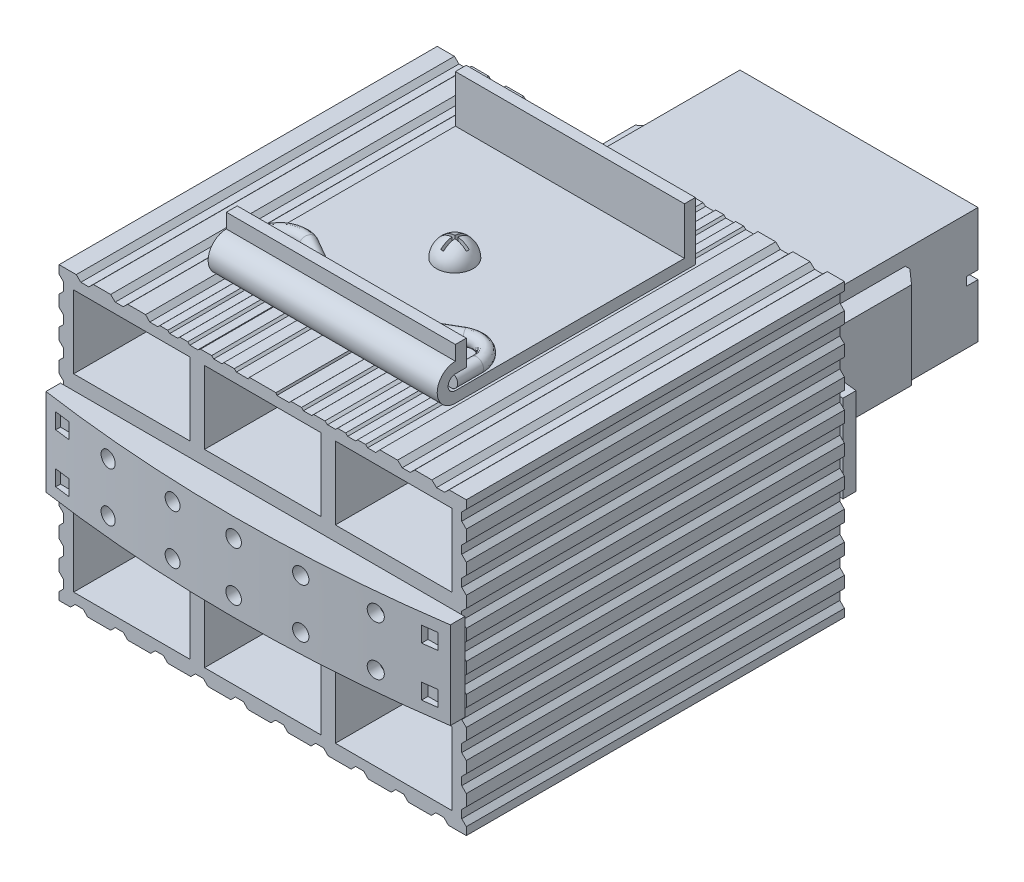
SolidWorks part; units mm, degrees
other "LUMP1"
ref_plane "Спереди" through (0, 0, 0) normal (0, 0, 1) x (1, 0, 0)
ref_plane "Сверху" through (0, 0, 0) normal (0, 1, 0) x (1, 0, 0)
ref_plane "Справа" through (0, 0, 0) normal (1, 0, 0) x (0, 0, -1)
imported_body "Импортированный1"
sketch "Эскиз1" plane through (0, 0, 66.04) normal (0, 0, 1) x (1, 0, 0)
  line L0 (-35.56, 23.9572) -> (-34.76, 23.1572)
  line L1 (-35.56, 25.4) -> (-35.56, -25.4) construction
  line L2 (-34.76, 23.1572) -> (-34.76, 21.7572)
  line L3 (-34.76, 21.7572) -> (-35.56, 20.9572)
  line L4 (-35.56, 20.9572) -> (-36.4722, 20.9572)
  line L5 (-36.4722, 20.9572) -> (-36.4722, 23.9572)
  line L6 (-36.4722, 23.9572) -> (-35.56, 23.9572)
  line L7 (-35.56, 18.9572) -> (-34.76, 18.1572)
  line L8 (-34.76, 18.1572) -> (-34.76, 16.7572)
  line L9 (-34.76, 16.7572) -> (-35.56, 15.9572)
  line L10 (-35.56, 15.9572) -> (-36.4722, 15.9572)
  line L11 (-36.4722, 15.9572) -> (-36.4722, 18.9572)
  line L12 (-36.4722, 18.9572) -> (-35.56, 18.9572)
  line L13 (-35.56, 13.9572) -> (-34.76, 13.1572)
  line L14 (-34.76, 13.1572) -> (-34.76, 11.7572)
  line L15 (-34.76, 11.7572) -> (-35.56, 10.9572)
  line L16 (-35.56, 10.9572) -> (-36.4722, 10.9572)
  line L17 (-36.4722, 10.9572) -> (-36.4722, 13.9572)
  line L18 (-36.4722, 13.9572) -> (-35.56, 13.9572)
  line L19 (-35.56, 8.9572) -> (-34.76, 8.1572)
  line L20 (-34.76, 8.1572) -> (-34.76, 6.7572)
  line L21 (-34.76, 6.7572) -> (-35.56, 5.9572)
  line L22 (-35.56, 5.9572) -> (-36.4722, 5.9572)
  line L23 (-36.4722, 5.9572) -> (-36.4722, 8.9572)
  line L24 (-36.4722, 8.9572) -> (-35.56, 8.9572)
  line L25 (-35.56, 3.9572) -> (-34.76, 3.1572)
  line L26 (-34.76, 3.1572) -> (-34.76, 1.7572)
  line L27 (-34.76, 1.7572) -> (-35.56, 0.9572)
  line L28 (-35.56, 0.9572) -> (-36.4722, 0.9572)
  line L29 (-36.4722, 0.9572) -> (-36.4722, 3.9572)
  line L30 (-36.4722, 3.9572) -> (-35.56, 3.9572)
  line L31 (-35.56, -1.0428) -> (-34.76, -1.8428)
  line L32 (-34.76, -1.8428) -> (-34.76, -3.2428)
  line L33 (-34.76, -3.2428) -> (-35.56, -4.0428)
  line L34 (-35.56, -4.0428) -> (-36.4722, -4.0428)
  line L35 (-36.4722, -4.0428) -> (-36.4722, -1.0428)
  line L36 (-36.4722, -1.0428) -> (-35.56, -1.0428)
  line L37 (-35.56, -6.0428) -> (-34.76, -6.8428)
  line L38 (-34.76, -6.8428) -> (-34.76, -8.2428)
  line L39 (-34.76, -8.2428) -> (-35.56, -9.0428)
  line L40 (-35.56, -9.0428) -> (-36.4722, -9.0428)
  line L41 (-36.4722, -9.0428) -> (-36.4722, -6.0428)
  line L42 (-36.4722, -6.0428) -> (-35.56, -6.0428)
  line L43 (-35.56, -11.0428) -> (-34.76, -11.8428)
  line L44 (-34.76, -11.8428) -> (-34.76, -13.2428)
  line L45 (-34.76, -13.2428) -> (-35.56, -14.0428)
  line L46 (-35.56, -14.0428) -> (-36.4722, -14.0428)
  line L47 (-36.4722, -14.0428) -> (-36.4722, -11.0428)
  line L48 (-36.4722, -11.0428) -> (-35.56, -11.0428)
  line L49 (-35.56, -16.0428) -> (-34.76, -16.8428)
  line L50 (-34.76, -16.8428) -> (-34.76, -18.2428)
  line L51 (-34.76, -18.2428) -> (-35.56, -19.0428)
  line L52 (-35.56, -19.0428) -> (-36.4722, -19.0428)
  line L53 (-36.4722, -19.0428) -> (-36.4722, -16.0428)
  line L54 (-36.4722, -16.0428) -> (-35.56, -16.0428)
  line L55 (-35.56, -21.0428) -> (-34.76, -21.8428)
  line L56 (-34.76, -21.8428) -> (-34.76, -23.2428)
  line L57 (-34.76, -23.2428) -> (-35.56, -24.0428)
  line L58 (-35.56, -24.0428) -> (-36.4722, -24.0428)
  line L59 (-36.4722, -24.0428) -> (-36.4722, -21.0428)
  line L60 (-36.4722, -21.0428) -> (-35.56, -21.0428)
  line L61 (0, 0) -> (0, -10.16) construction
  line L62 (-10.16, -10.16) -> (10.16, -10.16) construction
  line L63 (36.4722, -21.0428) -> (35.56, -21.0428)
  line L64 (36.4722, -24.0428) -> (36.4722, -21.0428)
  line L65 (35.56, -24.0428) -> (36.4722, -24.0428)
  line L66 (34.76, -23.2428) -> (35.56, -24.0428)
  line L67 (34.76, -21.8428) -> (34.76, -23.2428)
  line L68 (35.56, -21.0428) -> (34.76, -21.8428)
  line L69 (36.4722, -16.0428) -> (35.56, -16.0428)
  line L70 (36.4722, -19.0428) -> (36.4722, -16.0428)
  line L71 (35.56, -19.0428) -> (36.4722, -19.0428)
  line L72 (34.76, -18.2428) -> (35.56, -19.0428)
  line L73 (34.76, -16.8428) -> (34.76, -18.2428)
  line L74 (35.56, -16.0428) -> (34.76, -16.8428)
  line L75 (36.4722, -11.0428) -> (35.56, -11.0428)
  line L76 (36.4722, -14.0428) -> (36.4722, -11.0428)
  line L77 (35.56, -14.0428) -> (36.4722, -14.0428)
  line L78 (34.76, -13.2428) -> (35.56, -14.0428)
  line L79 (34.76, -11.8428) -> (34.76, -13.2428)
  line L80 (35.56, -11.0428) -> (34.76, -11.8428)
  line L81 (36.4722, -6.0428) -> (35.56, -6.0428)
  line L82 (36.4722, -9.0428) -> (36.4722, -6.0428)
  line L83 (35.56, -9.0428) -> (36.4722, -9.0428)
  line L84 (34.76, -8.2428) -> (35.56, -9.0428)
  line L85 (34.76, -6.8428) -> (34.76, -8.2428)
  line L86 (35.56, -6.0428) -> (34.76, -6.8428)
  line L87 (36.4722, -1.0428) -> (35.56, -1.0428)
  line L88 (36.4722, -4.0428) -> (36.4722, -1.0428)
  line L89 (35.56, -4.0428) -> (36.4722, -4.0428)
  line L90 (34.76, -3.2428) -> (35.56, -4.0428)
  line L91 (34.76, -1.8428) -> (34.76, -3.2428)
  line L92 (35.56, -1.0428) -> (34.76, -1.8428)
  line L93 (36.4722, 3.9572) -> (35.56, 3.9572)
  line L94 (36.4722, 0.9572) -> (36.4722, 3.9572)
  line L95 (35.56, 0.9572) -> (36.4722, 0.9572)
  line L96 (34.76, 1.7572) -> (35.56, 0.9572)
  line L97 (34.76, 3.1572) -> (34.76, 1.7572)
  line L98 (35.56, 3.9572) -> (34.76, 3.1572)
  line L99 (36.4722, 8.9572) -> (35.56, 8.9572)
  line L100 (36.4722, 5.9572) -> (36.4722, 8.9572)
  line L101 (35.56, 5.9572) -> (36.4722, 5.9572)
  line L102 (34.76, 6.7572) -> (35.56, 5.9572)
  line L103 (34.76, 8.1572) -> (34.76, 6.7572)
  line L104 (35.56, 8.9572) -> (34.76, 8.1572)
  line L105 (36.4722, 13.9572) -> (35.56, 13.9572)
  line L106 (36.4722, 10.9572) -> (36.4722, 13.9572)
  line L107 (35.56, 10.9572) -> (36.4722, 10.9572)
  line L108 (34.76, 11.7572) -> (35.56, 10.9572)
  line L109 (34.76, 13.1572) -> (34.76, 11.7572)
  line L110 (35.56, 13.9572) -> (34.76, 13.1572)
  line L111 (36.4722, 18.9572) -> (35.56, 18.9572)
  line L112 (36.4722, 15.9572) -> (36.4722, 18.9572)
  line L113 (35.56, 15.9572) -> (36.4722, 15.9572)
  line L114 (34.76, 16.7572) -> (35.56, 15.9572)
  line L115 (34.76, 18.1572) -> (34.76, 16.7572)
  line L116 (35.56, 18.9572) -> (34.76, 18.1572)
  line L117 (36.4722, 23.9572) -> (35.56, 23.9572)
  line L118 (36.4722, 20.9572) -> (36.4722, 23.9572)
  line L119 (35.56, 20.9572) -> (36.4722, 20.9572)
  line L120 (34.76, 21.7572) -> (35.56, 20.9572)
  line L121 (34.76, 23.1572) -> (34.76, 21.7572)
  line L122 (35.56, 23.9572) -> (34.76, 23.1572)
  dimension "D2" = 0.8
  dimension "D3" = 1.4
  dimension "D4" = 3
  dimension "D1" = 10
extrude "Вырез-Вытянуть1" cut sketch "Эскиз1" against normal up to surface (66.04 mm away)
sketch "Эскиз2" plane through (0, 0, 66.04) normal (0, 0, 1) x (1, 0, 0)
  line L0 (-33.56, -25.4) -> (-32.76, -24.6)
  line L1 (-35.56, -25.4) -> (35.56, -25.4) construction
  line L2 (-32.76, -24.6) -> (-31.36, -24.6)
  line L3 (-31.36, -24.6) -> (-30.56, -25.4)
  line L4 (-30.56, -25.4) -> (-30.56, -26.3489)
  line L5 (-30.56, -26.3489) -> (-33.56, -26.3489)
  line L6 (-33.56, -26.3489) -> (-33.56, -25.4)
  line L7 (-26.56, -25.4) -> (-25.76, -24.6)
  line L8 (-25.76, -24.6) -> (-24.36, -24.6)
  line L9 (-24.36, -24.6) -> (-23.56, -25.4)
  line L10 (-23.56, -25.4) -> (-23.56, -26.3489)
  line L11 (-23.56, -26.3489) -> (-26.56, -26.3489)
  line L12 (-26.56, -26.3489) -> (-26.56, -25.4)
  line L13 (-19.56, -25.4) -> (-18.76, -24.6)
  line L14 (-18.76, -24.6) -> (-17.36, -24.6)
  line L15 (-17.36, -24.6) -> (-16.56, -25.4)
  line L16 (-16.56, -25.4) -> (-16.56, -26.3489)
  line L17 (-16.56, -26.3489) -> (-19.56, -26.3489)
  line L18 (-19.56, -26.3489) -> (-19.56, -25.4)
  line L19 (-12.56, -25.4) -> (-11.76, -24.6)
  line L20 (-11.76, -24.6) -> (-10.36, -24.6)
  line L21 (-10.36, -24.6) -> (-9.56, -25.4)
  line L22 (-9.56, -25.4) -> (-9.56, -26.3489)
  line L23 (-9.56, -26.3489) -> (-12.56, -26.3489)
  line L24 (-12.56, -26.3489) -> (-12.56, -25.4)
  line L25 (-5.56, -25.4) -> (-4.76, -24.6)
  line L26 (-4.76, -24.6) -> (-3.36, -24.6)
  line L27 (-3.36, -24.6) -> (-2.56, -25.4)
  line L28 (-2.56, -25.4) -> (-2.56, -26.3489)
  line L29 (-2.56, -26.3489) -> (-5.56, -26.3489)
  line L30 (-5.56, -26.3489) -> (-5.56, -25.4)
  line L31 (1.44, -25.4) -> (2.24, -24.6)
  line L32 (2.24, -24.6) -> (3.64, -24.6)
  line L33 (3.64, -24.6) -> (4.44, -25.4)
  line L34 (4.44, -25.4) -> (4.44, -26.3489)
  line L35 (4.44, -26.3489) -> (1.44, -26.3489)
  line L36 (1.44, -26.3489) -> (1.44, -25.4)
  line L37 (8.44, -25.4) -> (9.24, -24.6)
  line L38 (9.24, -24.6) -> (10.64, -24.6)
  line L39 (10.64, -24.6) -> (11.44, -25.4)
  line L40 (11.44, -25.4) -> (11.44, -26.3489)
  line L41 (11.44, -26.3489) -> (8.44, -26.3489)
  line L42 (8.44, -26.3489) -> (8.44, -25.4)
  line L43 (15.44, -25.4) -> (16.24, -24.6)
  line L44 (16.24, -24.6) -> (17.64, -24.6)
  line L45 (17.64, -24.6) -> (18.44, -25.4)
  line L46 (18.44, -25.4) -> (18.44, -26.3489)
  line L47 (18.44, -26.3489) -> (15.44, -26.3489)
  line L48 (15.44, -26.3489) -> (15.44, -25.4)
  line L49 (22.44, -25.4) -> (23.24, -24.6)
  line L50 (23.24, -24.6) -> (24.64, -24.6)
  line L51 (24.64, -24.6) -> (25.44, -25.4)
  line L52 (25.44, -25.4) -> (25.44, -26.3489)
  line L53 (25.44, -26.3489) -> (22.44, -26.3489)
  line L54 (22.44, -26.3489) -> (22.44, -25.4)
  line L55 (29.44, -25.4) -> (30.24, -24.6)
  line L56 (30.24, -24.6) -> (31.64, -24.6)
  line L57 (31.64, -24.6) -> (32.44, -25.4)
  line L58 (32.44, -25.4) -> (32.44, -26.3489)
  line L59 (32.44, -26.3489) -> (29.44, -26.3489)
  line L60 (29.44, -26.3489) -> (29.44, -25.4)
  dimension "D1" = 0.8
  dimension "D2" = 1.4
  dimension "D3" = 3
  dimension "D4" = 2
  dimension "D5" = 10
extrude "Вырез-Вытянуть2" cut sketch "Эскиз2" against normal up to surface (66.04 mm away)
sketch "Эскиз3" plane through (0, 0, 66.04) normal (0, 0, 1) x (1, 0, 0)
  line L0 (-32.56, 25.4) -> (-31.76, 24.637)
  line L1 (35.56, 25.4) -> (-35.56, 25.4) construction
  line L2 (-31.76, 24.637) -> (-30.36, 24.637)
  line L3 (-30.36, 24.637) -> (-29.56, 25.4)
  line L4 (-29.56, 25.4) -> (-29.56, 26.4354)
  line L5 (-29.56, 26.4354) -> (-32.56, 26.4354)
  line L6 (-32.56, 26.4354) -> (-32.56, 25.4)
  line L7 (-26.56, 25.4) -> (-25.76, 24.637)
  line L8 (-25.76, 24.637) -> (-24.36, 24.637)
  line L9 (-24.36, 24.637) -> (-23.56, 25.4)
  line L10 (-23.56, 25.4) -> (-23.56, 26.4354)
  line L11 (-23.56, 26.4354) -> (-26.56, 26.4354)
  line L12 (-26.56, 26.4354) -> (-26.56, 25.4)
  line L13 (-20.4518, 25.4) -> (-19.7242, 24.637)
  line L14 (-19.7242, 24.637) -> (-18.3242, 24.637)
  line L15 (-18.3242, 24.637) -> (-17.9677, 24.977)
  line L16 (-17.9677, 24.977) -> (-16.5677, 24.977)
  line L17 (-16.5677, 24.977) -> (-16.2435, 24.637)
  line L18 (-16.2435, 24.637) -> (-14.8435, 24.637)
  line L19 (-14.8435, 24.637) -> (-14.487, 24.977)
  line L20 (-14.487, 24.977) -> (-13.087, 24.977)
  line L21 (-13.087, 24.977) -> (-12.7306, 24.637)
  line L22 (-12.7306, 24.637) -> (-11.3306, 24.637)
  line L23 (-11.3306, 24.637) -> (-10.8597, 24.977)
  line L24 (-10.8597, 24.977) -> (-8.9153, 24.977)
  line L25 (0, 25.4) -> (0, 18.4841) construction
  line L26 (-8.9153, 24.977) -> (-8.5589, 24.637)
  line L27 (-8.5589, 24.637) -> (-7.1071, 24.637)
  line L28 (-7.1071, 24.637) -> (-6.7829, 24.977)
  line L29 (-6.7829, 24.977) -> (-4.9544, 24.977)
  line L30 (-4.9544, 24.977) -> (-4.598, 24.637)
  line L31 (-4.598, 24.637) -> (-2.4717, 24.637)
  line L32 (-2.4717, 24.637) -> (-2.3139, 24.977)
  line L33 (-2.3139, 24.977) -> (2.3139, 24.977)
  line L34 (2.4717, 24.637) -> (2.3139, 24.977)
  line L35 (4.598, 24.637) -> (2.4717, 24.637)
  line L36 (4.9544, 24.977) -> (4.598, 24.637)
  line L37 (6.7829, 24.977) -> (4.9544, 24.977)
  line L38 (7.1071, 24.637) -> (6.7829, 24.977)
  line L39 (8.5589, 24.637) -> (7.1071, 24.637)
  line L40 (8.9153, 24.977) -> (8.5589, 24.637)
  line L41 (10.8597, 24.977) -> (8.9153, 24.977)
  line L42 (11.3306, 24.637) -> (10.8597, 24.977)
  line L43 (12.7306, 24.637) -> (11.3306, 24.637)
  line L44 (13.087, 24.977) -> (12.7306, 24.637)
  line L45 (14.487, 24.977) -> (13.087, 24.977)
  line L46 (14.8435, 24.637) -> (14.487, 24.977)
  line L47 (16.2435, 24.637) -> (14.8435, 24.637)
  line L48 (16.5677, 24.977) -> (16.2435, 24.637)
  line L49 (17.9677, 24.977) -> (16.5677, 24.977)
  line L50 (18.3242, 24.637) -> (17.9677, 24.977)
  line L51 (19.7242, 24.637) -> (18.3242, 24.637)
  line L52 (20.4518, 25.4) -> (19.7242, 24.637)
  line L53 (26.56, 26.4354) -> (26.56, 25.4)
  line L54 (23.56, 26.4354) -> (26.56, 26.4354)
  line L55 (23.56, 25.4) -> (23.56, 26.4354)
  line L56 (24.36, 24.637) -> (23.56, 25.4)
  line L57 (25.76, 24.637) -> (24.36, 24.637)
  line L58 (26.56, 25.4) -> (25.76, 24.637)
  line L59 (32.56, 26.4354) -> (32.56, 25.4)
  line L60 (29.56, 26.4354) -> (32.56, 26.4354)
  line L61 (29.56, 25.4) -> (29.56, 26.4354)
  line L62 (30.36, 24.637) -> (29.56, 25.4)
  line L63 (31.76, 24.637) -> (30.36, 24.637)
  line L64 (32.56, 25.4) -> (31.76, 24.637)
  line L65 (20.4518, 25.4) -> (20.4518, 25.6267)
  line L66 (20.4518, 25.6267) -> (20.0025, 25.6267)
  line L67 (20.0025, 25.4) -> (20.0025, 31.75) construction
  line L68 (20.0025, 25.6267) -> (20.0025, 25.4)
  line L69 (20.0025, 25.4) -> (-20.0025, 25.4)
  line L70 (-20.0025, 25.4) -> (-20.0025, 25.6089)
  line L71 (-20.0025, 31.75) -> (-20.0025, 25.4) construction
  line L72 (-20.0025, 25.6089) -> (-20.4518, 25.6089)
  line L73 (-20.4518, 25.6089) -> (-20.4518, 25.4)
  point P40 (0, 24.977)
  dimension "D1" = 3
  dimension "D2" = 0.8
  dimension "D3" = 1.4
  dimension "D5" = 1.4
  dimension "D6" = 1.4
  dimension "D7" = 1.4
  dimension "D8" = 1.4
  dimension "D9" = 1.4
  dimension "D10" = 3
  dimension "D4" = 2
extrude "Вырез-Вытянуть3" cut sketch "Эскиз3" against normal up to surface (66.04 mm away)
ref_plane "Плоскость1" through (0, 0, 72.04) normal (0, 0, 1) x (1, 0, 0)
sketch "Эскиз4" plane through (0, 0, 72.04) normal (0, 0, 1) x (1, 0, 0)
  line L0 (-35.306, 0) -> (-12.5766, 0) construction
  line L1 (-35.306, -7.62) -> (-35.306, 7.62) construction
  line L2 (33.398, -5.6739) -> (33.398, -2.949)
  line L3 (-33.3281, 5.6739) -> (-30.673, 5.6739)
  line L4 (-33.3281, 5.6739) -> (-33.3281, 2.949)
  line L5 (-33.3281, 2.949) -> (-30.673, 2.949)
  line L6 (-30.673, 5.6739) -> (-30.673, 2.949)
  line L7 (30.8826, 5.6739) -> (33.398, 5.6739)
  line L8 (30.8826, 5.6739) -> (30.8826, 2.949)
  line L9 (30.8826, 2.949) -> (33.398, 2.949)
  line L10 (33.398, 5.6739) -> (33.398, 2.949)
  line L11 (30.8826, -2.949) -> (33.398, -2.949)
  line L12 (30.8826, -5.6739) -> (30.8826, -2.949)
  line L13 (30.8826, -5.6739) -> (33.398, -5.6739)
  line L14 (-30.673, -5.6739) -> (-30.673, -2.949)
  line L15 (-33.3281, -2.949) -> (-30.673, -2.949)
  line L16 (-33.3281, -5.6739) -> (-33.3281, -2.949)
  line L17 (-33.3281, -5.6739) -> (-30.673, -5.6739)
  circle A0 centre (-22.9873, 4.3115) radius 1.3625
  circle A1 centre (-10.8998, 4.3115) radius 1.3625
  circle A2 centre (0, 4.3115) radius 1.3625
  circle A3 centre (11.4587, 4.3115) radius 1.3625
  circle A4 centre (23.686, 4.3115) radius 1.3625
  circle A5 centre (23.686, -4.3115) radius 1.3625
  circle A6 centre (11.4587, -4.3115) radius 1.3625
  circle A7 centre (0, -4.3115) radius 1.3625
  circle A8 centre (-10.8998, -4.3115) radius 1.3625
  circle A9 centre (-22.9873, -4.3115) radius 1.3625
extrude "Вырез-Вытянуть4" cut sketch "Эскиз4" against normal blind 4
sketch "Эскиз5" plane through (0, -10.16, 0) normal (0, -1, 0) x (1, 0, 0)
  line L0 (-18.2499, -35.56) -> (-18.2499, -30.48) construction
  line L1 (-6.6724, -7.3267) -> (-5.9724, -7.3267)
  line L2 (-6.6724, -7.3267) -> (-6.6724, -35.8124)
  line L3 (-19.4499, -36.1399) -> (19.3448, -36.1399)
  line L4 (-5.9724, -7.3267) -> (-5.9724, -35.8124)
  line L5 (6.5957, -7.3267) -> (5.8957, -7.3267)
  line L6 (6.5957, -7.3267) -> (6.5957, -35.8124)
  line L8 (5.8957, -7.3267) -> (5.8957, -35.8124)
  line L9 (18.6448, -7.3267) -> (19.3448, -7.3267)
  line L10 (18.6448, -7.3267) -> (18.6448, -35.8124)
  line L12 (19.3448, -7.3267) -> (19.3448, -36.1399)
  line L13 (-18.6499, -7.3267) -> (-19.4499, -7.3267)
  line L14 (-18.6499, -7.3267) -> (-18.6499, -35.8124)
  line L16 (-19.4499, -7.3267) -> (-19.4499, -36.1399)
  line L17 (18.2448, -35.56) -> (18.2448, -30.48) construction
  line L18 (-18.6499, -35.8124) -> (-6.6724, -35.8124)
  line L20 (-5.9724, -35.8124) -> (5.8957, -35.8124)
  line L22 (6.5957, -35.8124) -> (18.6448, -35.8124)
  dimension "D1" = 0.8
  dimension "D2" = 0.7
  dimension "D3" = 0.7
  dimension "D4" = 0.7
  dimension "D5" = 0.4
  dimension "D6" = 0.4
extrude "Вырез-Вытянуть5" cut sketch "Эскиз5" against normal blind 2
sketch "Эскиз6" plane through (0, -11.684, 0) normal (0, -1, 0) x (1, 0, 0)
  circle A0 centre (-12.5908, -33.02) radius 2.0037
extrude "Вырез-Вытянуть6" cut sketch "Эскиз6" against normal blind 0.5
sketch "Эскиз7" plane through (0, -11.184, 0) normal (0, -1, 0) x (1, 0, 0)
  line L0 (-12.5908, -31.0163) -> (-12.5908, -36.3312) construction
  line L2 (-13.5908, -34.1084) -> (-11.5908, -34.1084)
  line L3 (-13.5908, -34.1084) -> (-13.5908, -34.3484)
  line L4 (-13.5908, -34.3484) -> (-11.5908, -34.3484)
  line L5 (-11.5908, -34.1084) -> (-11.5908, -34.3484)
  line L6 (-13.9408, -33.4684) -> (-11.2408, -33.4684)
  line L7 (-13.9408, -33.4684) -> (-13.9408, -33.7084)
  line L8 (-13.9408, -33.7084) -> (-11.2408, -33.7084)
  line L9 (-11.2408, -33.4684) -> (-11.2408, -33.7084)
  line L10 (-13.9908, -32.8284) -> (-12.7108, -32.8284)
  line L11 (-13.9908, -32.8284) -> (-13.9908, -33.0684)
  line L12 (-13.9908, -33.0684) -> (-11.1908, -33.0684)
  line L13 (-11.1908, -32.8284) -> (-11.1908, -33.0684)
  line L14 (-12.7108, -31.4674) -> (-12.4708, -31.4674)
  line L15 (-12.7108, -31.4674) -> (-12.7108, -32.8284)
  line L17 (-12.4708, -31.4674) -> (-12.4708, -32.8284)
  line L18 (-12.4708, -32.8284) -> (-11.1908, -32.8284)
  circle A0 centre (-12.5908, -33.02) radius 2.0037 construction
  circle A1 centre (-12.5908, -33.02) radius 2.0037 construction
  dimension "D1" = 0.24
  dimension "D2" = 0.24
  dimension "D3" = 0.24
  dimension "D4" = 0.24
  dimension "D5" = 0.12
  dimension "D6" = 1.4
  dimension "D7" = 1.4
  dimension "D8" = 1.35
  dimension "D9" = 1.35
  dimension "D10" = 0.4
  dimension "D11" = 0.4
  dimension "D12" = 1
  dimension "D13" = 1
extrude "Бобышка-Вытянуть1" add sketch "Эскиз7" along normal blind 0.6
sketch "Эскиз8" plane through (0, -11.684, 0) normal (0, -1, 0) x (1, 0, 0)
  circle A0 centre (-0.0025, -33.02) radius 1.985
extrude "Вырез-Вытянуть7" cut sketch "Эскиз8" against normal blind 0.5
sketch "Эскиз9" plane through (0, -11.184, 0) normal (0, -1, 0) x (1, 0, 0)
  line L0 (-0.2924, -31.3361) -> (-0.2924, -33.9361)
  line L1 (-0.2924, -33.9361) -> (1.3076, -33.9361)
  line L2 (1.3076, -33.9361) -> (1.3076, -34.2361)
  line L3 (1.3076, -34.2361) -> (-0.5924, -34.2361)
  line L4 (-0.5924, -34.2361) -> (-0.5924, -31.3361)
  line L5 (-0.5924, -31.3361) -> (-0.2924, -31.3361)
  text T0 "L"
  dimension "D1" = 0.3
  dimension "D2" = 0.3
  dimension "D3" = 2.9
  dimension "D4" = 1.6
extrude "Бобышка-Вытянуть2" add sketch "Эскиз9" along normal blind 0.6
sketch "Эскиз10" plane through (0, -11.684, 0) normal (0, -1, 0) x (1, 0, 0)
  circle A0 centre (12.5857, -33.02) radius 1.9934
extrude "Вырез-Вытянуть8" cut sketch "Эскиз10" against normal blind 0.5
sketch "Эскиз11" plane through (0, -11.184, 0) normal (0, -1, 0) x (1, 0, 0)
  line L0 (11.5915, -31.6587) -> (13.6016, -34.1117)
  line L1 (11.3191, -31.6587) -> (11.5915, -31.6587)
  line L2 (11.3191, -31.6587) -> (11.3191, -34.4171)
  line L3 (11.3191, -34.4171) -> (11.5591, -34.4171)
  line L5 (13.6016, -31.6587) -> (13.8416, -31.6587)
  line L6 (13.6016, -31.6587) -> (13.6016, -34.1117)
  line L7 (13.5682, -34.4171) -> (13.8416, -34.4171)
  line L8 (13.8416, -31.6587) -> (13.8416, -34.4171)
  line L9 (13.5682, -34.4171) -> (11.5591, -31.9879)
  line L11 (11.5591, -31.9879) -> (11.5591, -34.4171)
  dimension "D1" = 0.24
  dimension "D2" = 0.24
extrude "Бобышка-Вытянуть3" add sketch "Эскиз11" along normal blind 0.6
sketch "Эскиз12" plane through (0, 0, -38.1) normal (0, 0, -1) x (-1, 0, 0)
  line L0 (-20.7892, -10.16) -> (-20.7892, 10.16) construction
  line L1 (-20.7892, 0.7132) -> (20.7892, 0.7132)
  line L2 (-20.7892, 0.7132) -> (-20.7892, -0.7541)
  line L3 (-20.7892, -0.7541) -> (20.7892, -0.7541)
  line L4 (20.7892, 0.7132) -> (20.7892, -0.7541)
  line L5 (20.7892, -7.62) -> (20.7892, 7.62) construction
extrude "Вырез-Вытянуть9" cut sketch "Эскиз12" against normal blind 2
ref_plane "Плоскость2" through (0, 0, -6) normal (0, 0, -1) x (-1, 0, 0)
sketch "Эскиз13" plane through (0, 0, -6) normal (0, 0, -1) x (-1, 0, 0)
  line L1 (-32.6616, 5.9411) -> (-30.1962, 5.9411)
  line L2 (-32.6616, 5.9411) -> (-32.6616, 3.3113)
  line L3 (-32.6616, 3.3113) -> (-30.1962, 3.3113)
  line L4 (-30.1962, 5.9411) -> (-30.1962, 3.3113)
  line L5 (32.8364, 5.9411) -> (30.4532, 5.9411)
  line L6 (32.8364, 5.9411) -> (32.8364, 3.3113)
  line L7 (32.8364, 3.3113) -> (30.4532, 3.3113)
  line L8 (30.4532, 5.9411) -> (30.4532, 3.3113)
  line L9 (32.8364, -6.2216) -> (30.4532, -6.2216)
  line L10 (32.8364, -6.2216) -> (32.8364, -3.4275)
  line L11 (32.8364, -3.4275) -> (30.4532, -3.4275)
  line L12 (30.4532, -6.2216) -> (30.4532, -3.4275)
  line L13 (-32.6616, -3.4275) -> (-30.1962, -3.4275)
  line L14 (-32.6616, -3.4275) -> (-32.6616, -6.2216)
  line L15 (-32.6616, -6.2216) -> (-30.1962, -6.2216)
  line L16 (-30.1962, -3.4275) -> (-30.1962, -6.2216)
extrude "Вырез-Вытянуть10" cut sketch "Эскиз13" against normal blind 4
ref_plane "Плоскость5" through (0, 28.555, 0) normal (0, 1, 0) x (1, 0, 0)
sketch "Эскиз14" plane through (0, 28.555, 0) normal (0, 1, 0) x (1, 0, 0)
  line L0 (-19.2178, -52.7898) -> (-19.2178, -47.6825)
  line L1 (-13.9246, -44.0398) -> (-1.007, -51.4978)
  line L2 (-20.0025, -50.4825) -> (20.0025, -50.4825) construction
  line L3 (0, -50.4825) -> (0, -25.7963) construction
  arc A0 (-19.2178, -47.6825) -> (-13.9246, -44.0398) centre (-15.3178, -47.6825) cw
  point P16 (-2.7809, -50.4825)
  dimension "D1" = 2.8
  dimension "D2" = 3.9
  dimension "D3" = 60
ref_plane "Плоскость6" through (0, 0, 52.3825) normal (0, 0, -1) x (-1, 0, 0)
sketch "Эскиз15" plane through (0, 0, 52.3825) normal (0, 0, -1) x (-1, 0, 0)
  line L1 (19.2178, 28.555) -> (13.9246, 28.555) construction
  circle A0 centre (19.1808, 28.555) radius 1.1804
sweep "По траектории3" add profiles "Эскиз15" path "Эскиз14"
ref_plane "Плоскость7" through (0, 0, 0) normal (-1, 0, 0) x (0, 0, 1)
sketch "Эскиз16" plane through (0, 28.555, 0) normal (0, 1, 0) x (1, 0, 0)
  line L0 (19.6345, -52.92) -> (19.6345, -47.8619)
  line L1 (13.7887, -44.305) -> (1.0968, -51.6326)
  line L2 (-20.0025, -50.4825) -> (20.0025, -50.4825) construction
  arc A0 (19.6345, -47.8619) -> (13.7887, -44.305) centre (15.7387, -47.6825) ccw
  dimension "D2" = 3.9
  dimension "D1" = 2.8
  dimension "D3" = 60
sketch "Эскиз17" plane through (0, 0, 52.3825) normal (0, 0, -1) x (-1, 0, 0)
  line L0 (-13.7887, 28.555) -> (-19.6387, 28.555) construction
  circle A0 centre (-19.1995, 28.555) radius 1.201
sweep "По траектории4" add profiles "Эскиз17" path "Эскиз16"
sketch "Эскиз18" plane through (0, 27.305, 0) normal (0, 1, 0) x (1, 0, 0)
  line L0 (-20.0025, -32.385) -> (20.0025, -32.385) construction
  line L1 (-20.0025, -52.3875) -> (-20.0025, -12.3825) construction
  line L2 (20.0025, -52.3875) -> (20.0025, -12.3825) construction
  line L3 (-3.3215, -32.385) -> (3.1089, -32.385)
  arc A0 (-3.3215, -32.385) -> (3.1089, -32.385) centre (-0.1063, -32.385) cw
revolve "Повернуть1" add sketch "Эскиз18" angle 180 about L0
ref_plane "Плоскость8" through (0, 32.305, 0) normal (0, 1, 0) x (1, 0, 0)
sketch "Эскиз19" plane through (0, 32.305, 0) normal (0, 1, 0) x (1, 0, 0)
  line L0 (-3.3215, -32.385) -> (3.1089, -32.385) construction
  line L1 (-0.0774, -29.1699) -> (-0.0774, -35.6001) construction
  line L2 (-0.0774, -30.135) -> (0.1726, -30.135)
  line L3 (0.1726, -30.135) -> (0.1726, -32.135)
  line L4 (0.1726, -32.135) -> (2.1726, -32.135)
  line L5 (2.1726, -32.135) -> (2.1726, -32.635)
  line L6 (2.1726, -32.635) -> (0.1726, -32.635)
  line L7 (0.1726, -32.635) -> (0.1726, -34.635)
  line L8 (0.1726, -34.635) -> (-0.3274, -34.635)
  line L9 (-0.3274, -34.635) -> (-0.3274, -32.635)
  line L10 (-0.3274, -32.635) -> (-2.3274, -32.635)
  line L11 (-2.3274, -32.635) -> (-2.3274, -32.135)
  line L12 (-2.3274, -32.135) -> (-0.3274, -32.135)
  line L13 (-0.3274, -32.135) -> (-0.3274, -30.135)
  line L14 (-0.3274, -30.135) -> (-0.0774, -30.135)
  circle A0 centre (-0.1063, -32.385) radius 3.2152 construction
  dimension "D1" = 0.25
  dimension "D2" = 0.25
  dimension "D3" = 0.25
  dimension "D4" = 0.25
  dimension "D5" = 0.25
  dimension "D6" = 0.25
  dimension "D7" = 0.25
  dimension "D8" = 0.25
  dimension "D9" = 2
  dimension "D10" = 2
  dimension "D11" = 2
  dimension "D12" = 2
  dimension "D13" = 2
extrude "Вырез-Вытянуть11" cut sketch "Эскиз19" against normal blind 4
